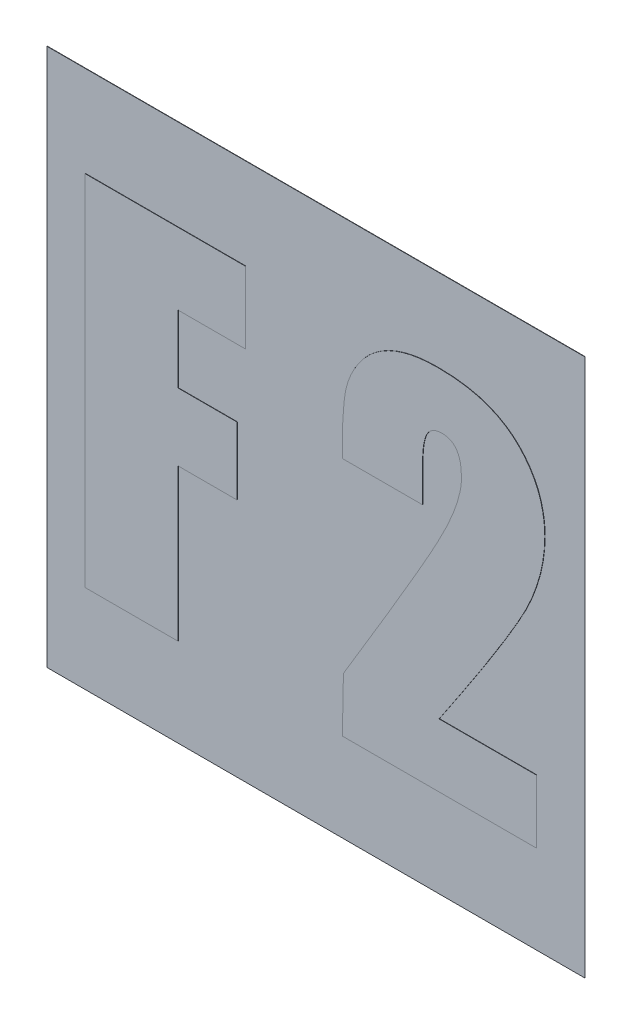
SolidWorks part; units mm, degrees
ref_plane "Plane1" through (0, 0, 0) normal (0, 0, 1) x (1, 0, 0)
ref_plane "Plane2" through (0, 0, 0) normal (0, 1, 0) x (1, 0, 0)
ref_plane "Plane3" through (0, 0, 0) normal (1, 0, 0) x (0, 0, -1)
sketch "Sketch1" plane through (0, 0, 0) normal (0, 0, 1) x (1, 0, 0)
  line L0 (-69.0098, 0) -> (69.0098, 0) construction
  line L1 (0, 52.3212) -> (0, -57.1323) construction
  line L2 (-7.5, 7.5) -> (7.5, 7.5)
  line L3 (-7.5, 7.5) -> (-7.5, -7.5)
  line L4 (7.5, 7.5) -> (7.5, -7.5)
  line L5 (-7.5, -7.5) -> (7.5, -7.5)
  point P8 (0, -7.5)
  point P11 (0, 7.5)
  point P12 (7.5, 0)
  point P13 (-7.5, 0)
  dimension "D1" = 15
  dimension "D2" = 15
extrude "Base-Extrude" add sketch "Sketch1" along normal blind 0.01
sketch "Sketch3" plane through (0, 0, 0.01) normal (0, 0, 1) x (1, 0, 0)
  text T0 "F 2" font "Impact" height in points 36
  point P1 (0, 0)
extrude "Boss-Extrude1" add sketch "Sketch3" along normal blind 0.01
